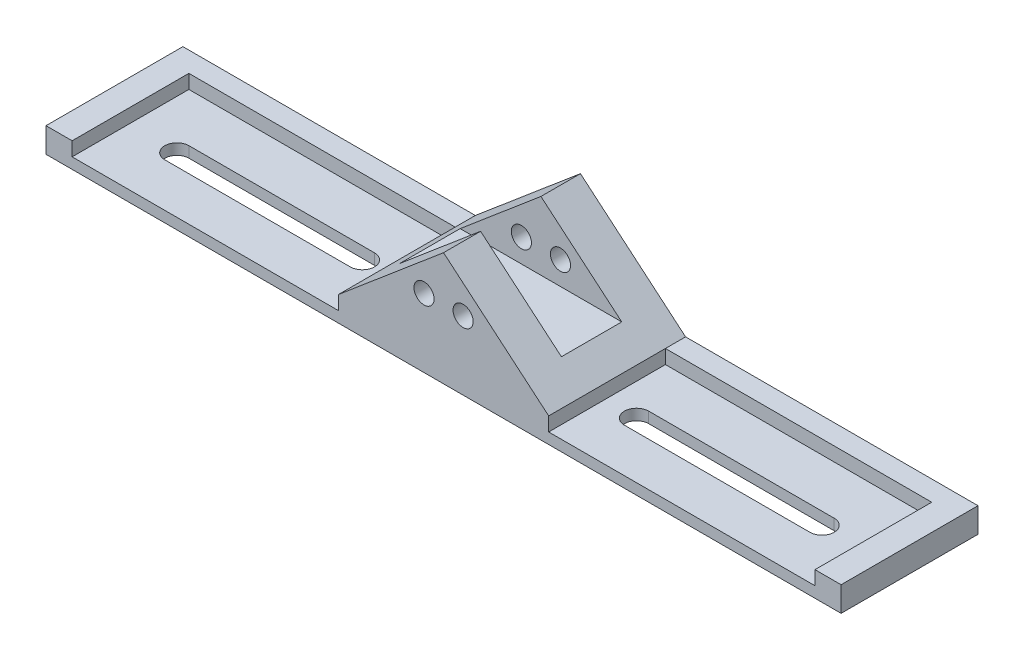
SolidWorks part; units mm, degrees
ref_plane "Front Plane" through (0, 0, 0) normal (0, 0, 1) x (1, 0, 0)
ref_plane "Top Plane" through (0, 0, 0) normal (0, 1, 0) x (1, 0, 0)
ref_plane "Right Plane" through (0, 0, 0) normal (1, 0, 0) x (0, 0, -1)
sketch "Sketch1" plane through (0, 0, 0) normal (0, 1, 0) x (1, 0, 0)
  line L1 (-70.5231, 53.3164) -> (226.4734, 53.3164)
  line L2 (-70.5231, 53.3164) -> (-70.5231, -48.9542)
  line L3 (-70.5231, -48.9542) -> (226.4734, -48.9542)
  line L4 (226.4734, 53.3164) -> (226.4734, -48.9542)
extrude "Extrude1" add sketch "Sketch1" along normal blind 18.542
sketch "Sketch2" plane through (0, 0, 48.9542) normal (0, 0, 1) x (1, 0, 0)
  line L0 (8.0057, 18.542) -> (-70.5231, 84.8669)
  line L1 (-70.5231, 18.542) -> (226.4734, 18.542) construction
  line L2 (-70.5231, 84.8669) -> (-70.5231, 18.542)
  line L3 (-70.5231, 18.542) -> (8.0057, 18.542)
extrude "Extrude2" add sketch "Sketch2" against normal up to surface (102.2706 mm away)
sketch "Sketch3" plane through (-70.5231, 0, 0) normal (-1, 0, 0) x (0, 0, 1)
  line L0 (-53.3164, 84.8669) -> (48.9542, 84.8669) construction
  line L1 (-23.7908, 84.8669) -> (21.2775, 84.8669)
  line L2 (-23.7908, 84.8669) -> (-23.7908, 33.8821)
  line L3 (-23.7908, 33.8821) -> (21.2775, 33.8821)
  line L4 (21.2775, 84.8669) -> (21.2775, 33.8821)
extrude "Cut-Extrude1" cut sketch "Sketch3" against normal through all
sketch "Sketch4" plane through (0, 18.542, 0) normal (0, 1, 0) x (-1, 0, 0)
  line L1 (-8.0057, 48.9542) -> (-206.9529, 48.9542)
  line L2 (-8.0057, 48.9542) -> (-8.0057, -38.266)
  line L3 (-8.0057, -38.266) -> (-206.9529, -38.266)
  line L4 (-206.9529, 48.9542) -> (-206.9529, -38.266)
extrude "Cut-Extrude2" cut sketch "Sketch4" against normal blind 10.414
sketch "Sketch5" plane through (0, 8.128, 0) normal (0, 1, 0) x (-1, 0, 0)
  line L0 (-170.4654, 16.268) -> (-31.9043, 16.268)
  line L1 (-170.4654, -1.908) -> (-31.9043, -1.908)
  line L2 (-170.4654, 7.18) -> (-68.2565, 7.18) construction
  arc A0 (-170.4654, 16.268) -> (-170.4654, -1.908) centre (-170.4654, 7.18) ccw
  arc A1 (-31.9043, -1.908) -> (-31.9043, 16.268) centre (-31.9043, 7.18) ccw
extrude "Cut-Extrude3" cut sketch "Sketch5" against normal through all
sketch "Sketch6" plane through (0, 0, 48.9542) normal (0, 0, 1) x (1, 0, 0)
  circle A0 centre (-55.916, 51.278) radius 7.5259
extrude "Cut-Extrude4" cut sketch "Sketch6" against normal through all
mirror "Mirror1" about plane through (-70.5231, 18.542, -53.3164) normal (1, 0, 0)
